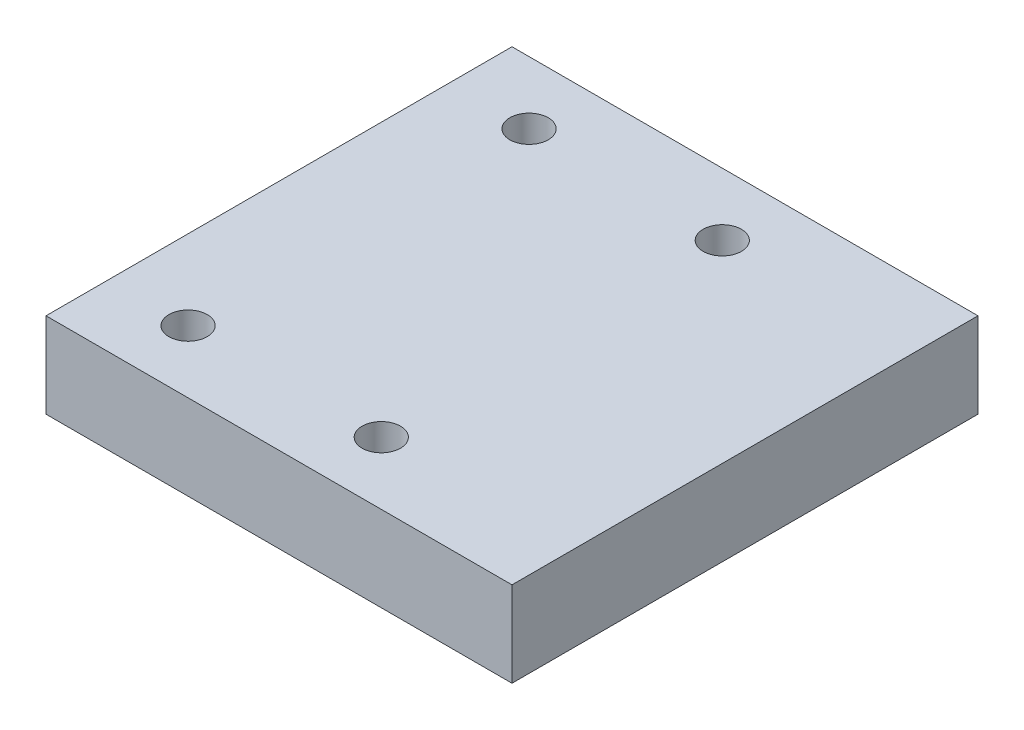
SolidWorks part; units mm, degrees
ref_plane "Face" through (0, 0, 0) normal (0, 0, 1) x (1, 0, 0)
ref_plane "Dessus" through (0, 0, 0) normal (0, 1, 0) x (1, 0, 0)
ref_plane "Droite" through (0, 0, 0) normal (1, 0, 0) x (0, 0, -1)
sketch "Esquisse1" plane through (0, 0, 0) normal (0, 0, 1) x (1, 0, 0)
  line L1 (-41, 0) -> (41, 0)
  line L2 (-41, 0) -> (-41, 15)
  line L3 (-41, 15) -> (41, 15)
  line L4 (41, 0) -> (41, 15)
  dimension "D1" = 82
  dimension "D2" = 15
extrude "Extrusion1" add sketch "Esquisse1" along normal mid plane 82
sketch "Esquisse2" plane through (0, 15, 0) normal (0, 1, 0) x (1, 0, 0)
  line L0 (41, -41) -> (41, 41) construction
  line L1 (0, 0) -> (53.1116, 0) construction
  circle A0 centre (-27, 30) radius 3.375
  circle A1 centre (7, 30) radius 3.375
  circle A2 centre (7, -30) radius 3.375
  circle A3 centre (-27, -30) radius 3.375
  dimension "D1" = 6.75
  dimension "D2" = 68
  dimension "D3" = 30
  dimension "D4" = 34
extrude "Enlèv. mat.-Extru.1" cut sketch "Esquisse2" against normal through all
